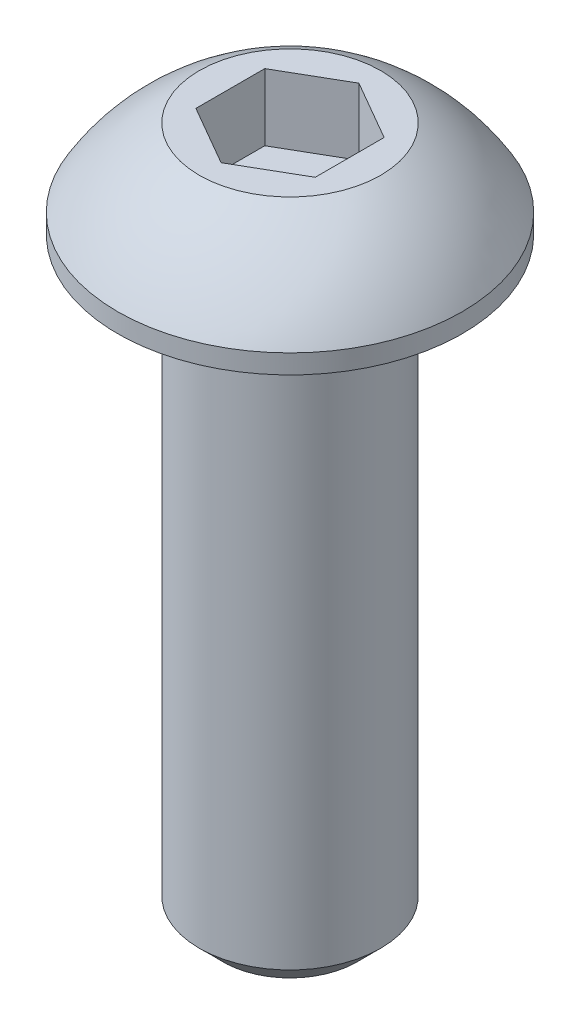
SolidWorks part; units mm, degrees
ref_plane "Front" through (0, 0, 0) normal (0, 0, 1) x (1, 0, 0)
ref_plane "Top" through (0, 0, 0) normal (0, 1, 0) x (1, 0, 0)
ref_plane "Right" through (0, 0, 0) normal (1, 0, 0) x (0, 0, -1)
sketch "Sketch1" plane through (0, 0, 0) normal (0, 0, 1) x (1, 0, 0)
  line L0 (0, 0) -> (4.5847, 0)
  line L1 (4.5847, 0) -> (4.5847, 0.508)
  line L2 (2.413, 2.5654) -> (0, 2.5654)
  line L3 (0, 2.5654) -> (0, 0)
  line L4 (0, 0) -> (0, 100) construction
  arc A0 (4.5847, 0.508) -> (2.413, 2.5654) centre (0, -2.1565) ccw
revolve "Base-Revolve" add sketch "Sketch1" angle 360 about L4
sketch "Sketch2" plane through (0, 0, 0) normal (0, 0, 1) x (1, 0, 0)
  line L0 (0, 0) -> (0, 100) construction
  line L1 (0, -15.875) -> (1.7831, -15.875)
  line L2 (1.7831, -15.875) -> (2.413, -15.2451)
  line L3 (2.413, -15.2451) -> (2.413, 0)
  line L4 (2.413, 0) -> (0, 0)
  line L5 (0, 0) -> (0, -15.875)
revolve "Boss-Revolve1" add sketch "Sketch2" angle 360 about L0
ref_plane "Plane4" through (0, 2.5654, 0) normal (0, 1, 0) x (-1, 0, 0)
sketch "Sketch3" plane through (0, 2.5654, 0) normal (0, 1, 0) x (-1, 0, 0)
  line L0 (1.5875, 0.9165) -> (0, 1.8331)
  line L1 (0, 1.8331) -> (-1.5875, 0.9165)
  line L2 (-1.5875, 0.9165) -> (-1.5875, -0.9165)
  line L3 (-1.5875, -0.9165) -> (0, -1.8331)
  line L4 (0, -1.8331) -> (1.5875, -0.9165)
  line L5 (1.5875, -0.9165) -> (1.5875, 0.9165)
extrude "Cut-Extrude1" cut sketch "Sketch3" against normal blind 1.778
